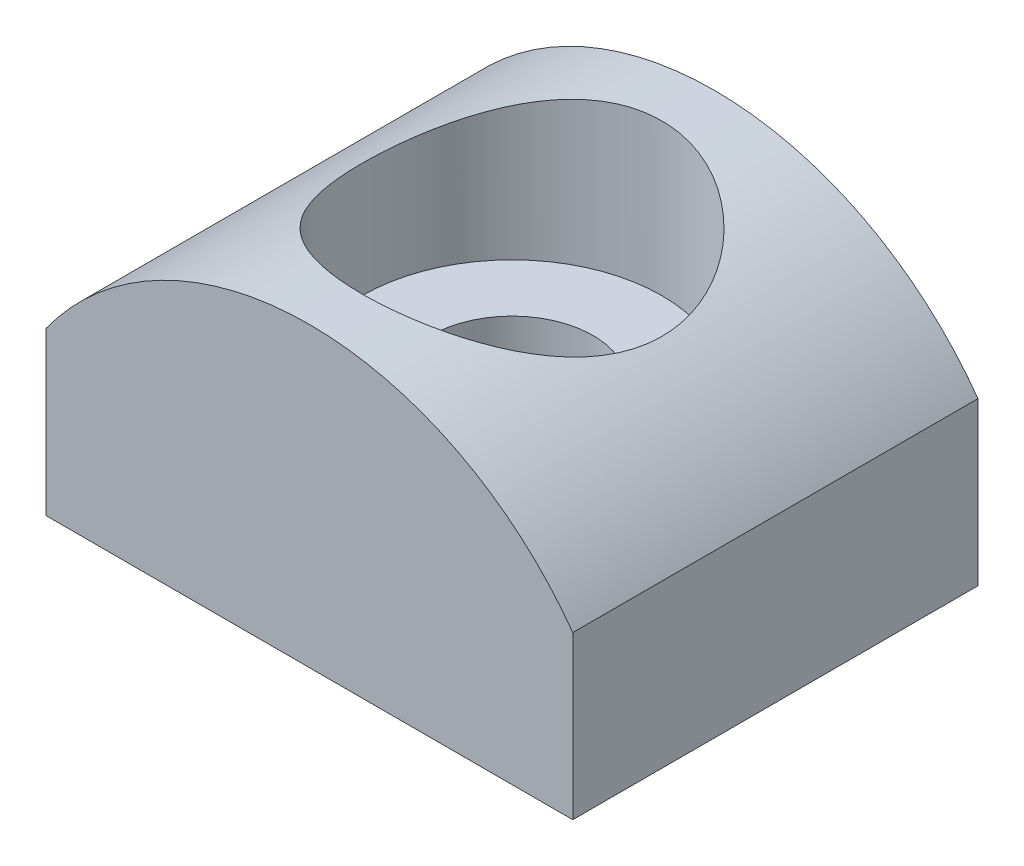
SolidWorks part; units mm, degrees
ref_plane "Plan1" through (0, 0, 0) normal (0, 0, 1) x (1, 0, 0)
ref_plane "Plan2" through (0, 0, 0) normal (0, 1, 0) x (1, 0, 0)
ref_plane "Plan3" through (0, 0, 0) normal (1, 0, 0) x (0, 0, -1)
sketch "Esquisse1" plane through (0, 0, 0) normal (0, 0, 1) x (1, 0, 0)
  line L0 (-6.5, 0) -> (6.5, 0)
  line L1 (-6.5, 0) -> (-6.5, 4)
  line L2 (6.5, 0) -> (6.5, 4)
  arc A0 (6.5, 4) -> (-6.5, 4) centre (0, -0.6637) ccw
  dimension "D2" = 4
  dimension "D3" = 8
  dimension "D1" = 13
extrude "Base-Extrusion" add sketch "Esquisse1" along normal mid plane 10
sketch "Esquisse2" plane through (0, 0, 0) normal (1, 0, 0) x (0, 0, -1)
  line L0 (-2, 0) -> (-2, 3.6)
  line L1 (-2, 3.6) -> (-3.7, 3.6)
  line L2 (-3.7, 3.6) -> (-3.7, 8)
  line L3 (0, 8) -> (0, 0)
  line L4 (0, 0) -> (-2, 0)
  line L5 (0, 8) -> (-3.7, 8)
  line L6 (-5, 0) -> (5, 0) construction
  line L7 (0, 5) -> (0, 1) construction
  dimension "D1" = 2
  dimension "D2" = 3.7
  dimension "D3" = 3.6
revolve "Enlèvement de matière-Révolution1" cut sketch "Esquisse2" angle 360 about L7
